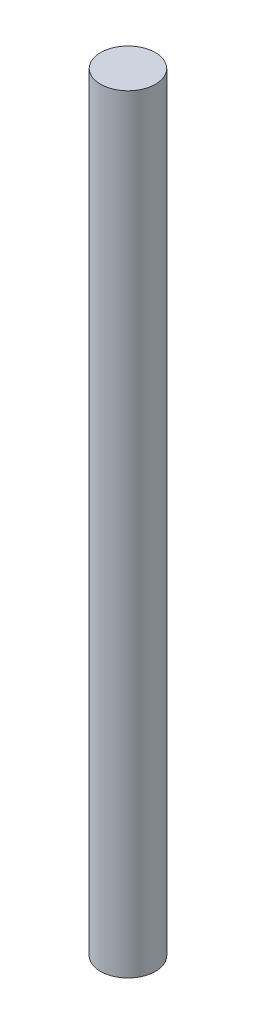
SolidWorks part; units mm, degrees
ref_plane "Front Plane" through (0, 0, 0) normal (0, 0, 1) x (1, 0, 0)
ref_plane "Top Plane" through (0, 0, 0) normal (0, 1, 0) x (1, 0, 0)
ref_plane "Right Plane" through (0, 0, 0) normal (1, 0, 0) x (0, 0, -1)
sketch "Sketch1" plane through (0, 0, 0) normal (0, 1, 0) x (1, 0, 0)
  circle A0 centre (0, 0) radius 3.175
  dimension "D1" = 6.35
extrude "Extrude1" add sketch "Sketch1" along normal blind 88.9
sketch "Sketch2" plane through (0, 88.9, 0) normal (0, 1, 0) x (-1, 0, 0)
  circle A0 centre (0, 0) radius 2.4892
  dimension "D1" = 4.9784
extrude "Extrude2" [suppressed] add sketch "Sketch2" along normal blind 5.588
sketch "Sketch3" plane through (0, 0, 0) normal (0, -1, 0) x (1, 0, 0)
  circle A0 centre (0, 0) radius 2.4892
  dimension "D1" = 4.9784
extrude "Extrude3" [suppressed] add sketch "Sketch3" along normal blind 5.588
